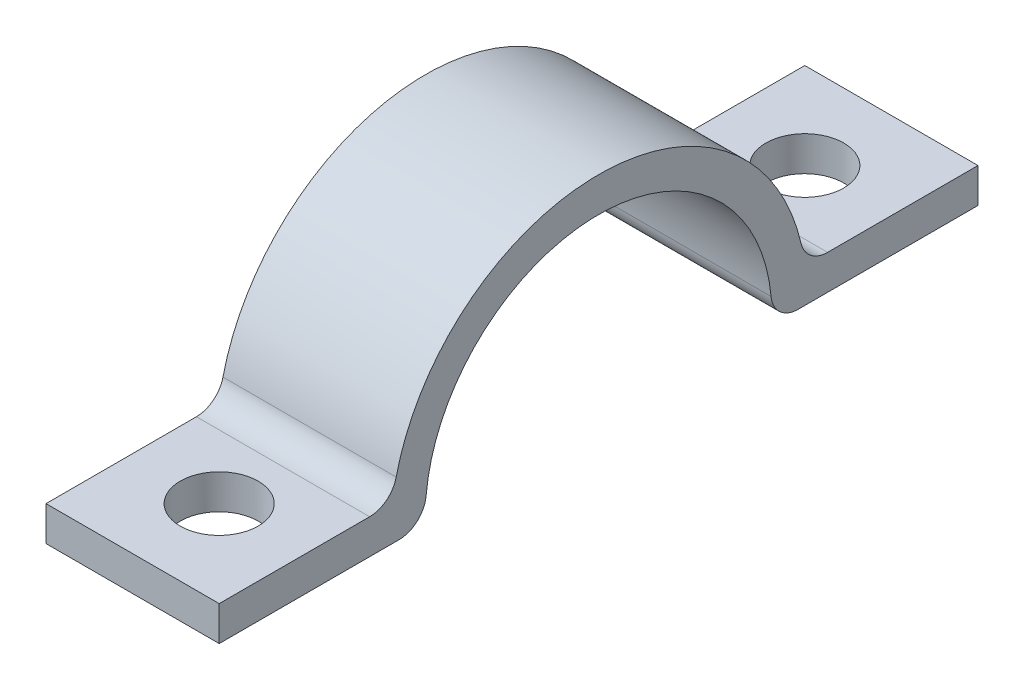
SolidWorks part; units mm, degrees
ref_plane "Front Plane" through (0, 0, 0) normal (0, 0, 1) x (1, 0, 0)
ref_plane "Top Plane" through (0, 0, 0) normal (0, 1, 0) x (1, 0, 0)
ref_plane "Right Plane" through (0, 0, 0) normal (1, 0, 0) x (0, 0, -1)
sketch "Sketch1" plane through (0, 0, 0) normal (1, 0, 0) x (0, 0, -1)
  line L0 (0, 0) -> (0, 6.35)
  line L1 (0, 6.35) -> (31.75, 6.35)
  line L2 (0, 0) -> (37.8012, 0)
  line L3 (0, 1.5875) -> (139.1023, 1.5875) construction
  line L4 (101.3012, 0) -> (139.1023, 0)
  line L5 (139.1023, 0) -> (139.1023, 6.35)
  line L6 (139.1023, 6.35) -> (107.3523, 6.35)
  line L7 (37.8012, 1.5875) -> (37.8012, 0)
  line L8 (101.3012, 1.5875) -> (101.3012, 0)
  circle A0 centre (69.5512, 1.5875) radius 31.75 construction
  circle A1 centre (69.5512, 1.5875) radius 38.1 construction
  arc A2 (31.75, 6.35) -> (107.3523, 6.35) centre (69.5512, 1.5875) cw
  arc A3 (37.8012, 1.5875) -> (101.3012, 1.5875) centre (69.5512, 1.5875) cw
  dimension "D3" = 63.5
  dimension "D4" = 76.2
  dimension "D1" = 31.75
  dimension "D2" = 6.35
  dimension "D5" = 1.5875
extrude "Boss-Extrude1" add sketch "Sketch1" along normal blind 31.75
sketch "Sketch2" plane through (0, 6.35, 0) normal (0, 1, 0) x (1, 0, 0)
  line L0 (0, 31.75) -> (0, 0) construction
  line L1 (0, 0) -> (31.75, 0) construction
  line L2 (31.75, 0) -> (31.75, 31.75) construction
  line L3 (31.75, 31.75) -> (0, 31.75) construction
  line L4 (0, 139.1023) -> (0, 107.3523) construction
  line L5 (0, 107.3523) -> (31.75, 107.3523) construction
  line L6 (31.75, 107.3523) -> (31.75, 139.1023) construction
  line L7 (31.75, 139.1023) -> (0, 139.1023) construction
  line L8 (0, 31.75) -> (0, 0) construction
  line L9 (0, 0) -> (31.75, 0) construction
  line L10 (31.75, 0) -> (31.75, 31.75) construction
  line L11 (31.75, 31.75) -> (0, 31.75) construction
  line L12 (0, 139.1023) -> (0, 107.3523) construction
  line L13 (0, 107.3523) -> (31.75, 107.3523) construction
  line L14 (31.75, 107.3523) -> (31.75, 139.1023) construction
  line L15 (31.75, 139.1023) -> (0, 139.1023) construction
  line L16 (0, 107.3523) -> (31.75, 139.1023) construction
  line L17 (0, 0) -> (31.75, 31.75) construction
  circle A0 centre (15.875, 123.2273) radius 7.1437
  circle A1 centre (15.875, 15.875) radius 7.1438
  dimension "D1" = 14.2875
extrude "Cut-Extrude1" cut sketch "Sketch2" against normal through all both and the other way through all
fillet "Fillet1" radius 5 4 edges at (15.875, 0, -101.3012) (15.875, 0, -37.8012) (15.875, 6.35, -107.3523) (15.875, 6.35, -31.75)
